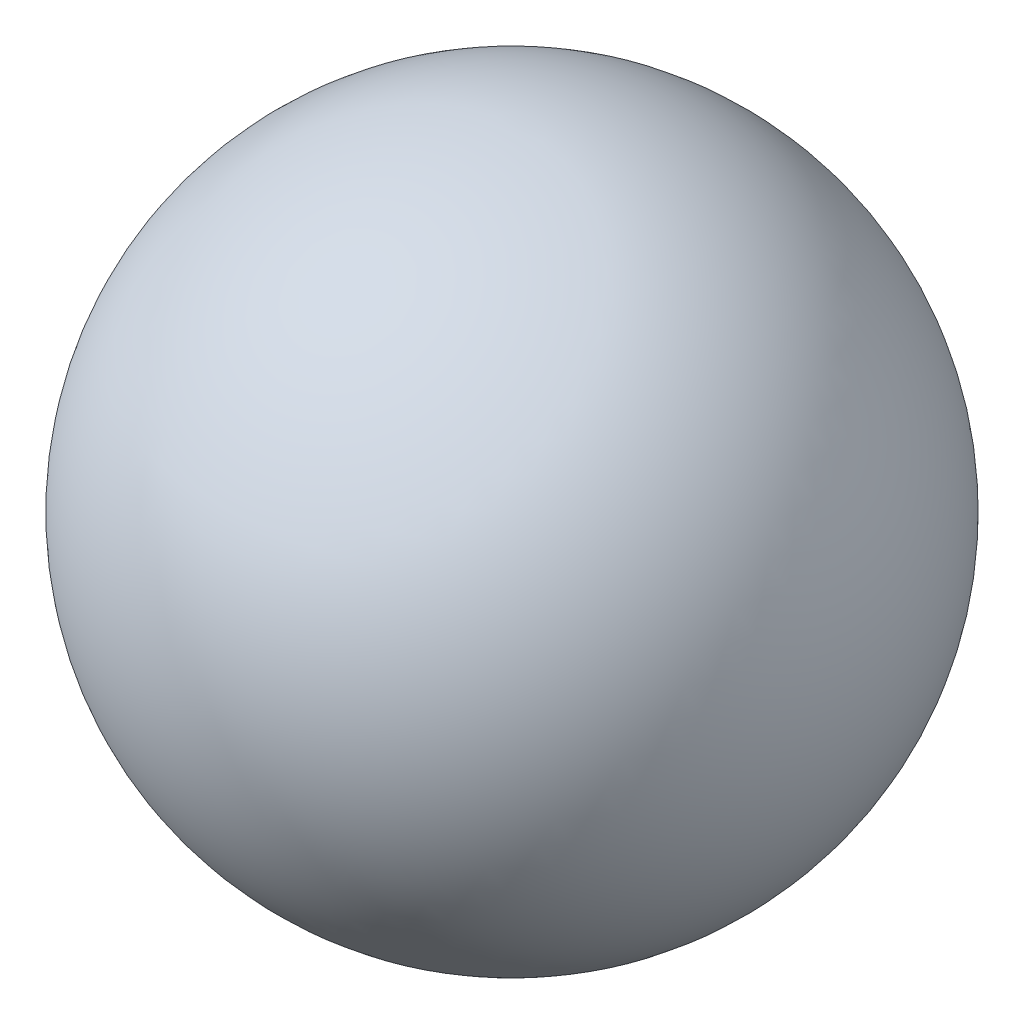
SolidWorks part; units mm, degrees
ref_plane "Front" through (0, 0, 0) normal (0, 0, 1) x (1, 0, 0)
ref_plane "Top" through (0, 0, 0) normal (0, 1, 0) x (1, 0, 0)
ref_plane "Right" through (0, 0, 0) normal (1, 0, 0) x (0, 0, -1)
sketch "Sketch1" plane through (0, 0, 0) normal (0, 0, 1) x (1, 0, 0)
  line L0 (0, 0) -> (0, 33.9352) construction
  line L1 (0, 0) -> (-61.1187, 0) construction
  line L2 (-61.1187, -4.9069) -> (-61.1187, 5.556) construction
  line L3 (-61.1187, -1.9844) -> (-61.1187, 1.9844)
  arc A0 (-61.1187, 1.9844) -> (-61.1187, -1.9844) centre (-61.1187, 0) ccw
  dimension "BALL DIA" = 3.9688
  dimension "PITCH DIA" = 122.2375
revolve "BALL" add sketch "Sketch1" angle 360 about L2
